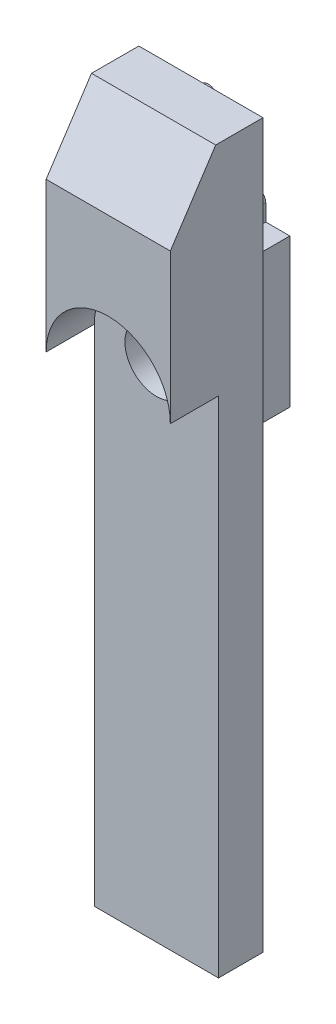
SolidWorks part; units mm, degrees
ref_plane "前视基准面" through (0, 0, 0) normal (0, 0, 1) x (1, 0, 0)
ref_plane "上视基准面" through (0, 0, 0) normal (0, 1, 0) x (1, 0, 0)
ref_plane "右视基准面" through (0, 0, 0) normal (1, 0, 0) x (0, 0, -1)
sketch "草图1" plane through (0, 0, 0) normal (0, 0, 1) x (1, 0, 0)
  line L1 (-16.75, -97.5) -> (16.75, -97.5)
  line L2 (-16.75, -97.5) -> (-16.75, 97.5)
  line L3 (-16.75, 97.5) -> (16.75, 97.5)
  line L4 (16.75, -97.5) -> (16.75, 97.5)
  line L5 (-16.75, -97.5) -> (16.75, 97.5) construction
  line L6 (-16.75, 97.5) -> (16.75, -97.5) construction
  point P0 (0, 0)
  dimension "D1" = 33.5
  dimension "D2" = 195
extrude "拉伸1" add sketch "草图1" along normal blind 25
sketch "草图2" plane through (0, 0, 25) normal (0, 0, 1) x (1, 0, 0)
  line L0 (-71.336, 38.5) -> (56.3179, 38.5) construction
  line L1 (16.75, 97.5) -> (-16.75, 97.5) construction
  line L2 (0, 0) -> (0, 102.4986) construction
  line L3 (16.75, -97.5) -> (16.75, 97.5) construction
  line L4 (-16.75, -97.5) -> (16.75, -97.5) construction
  line L5 (-16.75, 97.5) -> (-16.75, -97.5) construction
  line L6 (-16.75, -97.5) -> (16.75, -97.5)
  line L7 (-16.75, 38.5) -> (-16.75, -97.5)
  line L8 (16.75, -97.5) -> (16.75, 38.5)
  arc A0 (16.75, 38.5) -> (-16.75, 38.5) centre (0, 38.5) ccw
  dimension "D1" = 59
extrude "拉伸2" cut sketch "草图2" against normal blind 13
ref_plane "基准面2" [suppressed] through (0, 0, 0) normal (1, 0, 0) x (0, 0, -1)
sketch "草图3" plane through (-16.75, 0, 0) normal (-1, 0, 0) x (0, 0, 1)
  line L0 (5.5392, 108.5061) -> (31.4029, 69.0947)
extrude "拉伸3" cut sketch "草图3" against normal through all and the other way through all
sketch "草图4" plane through (0, 0, 12) normal (0, 0, 1) x (1, 0, 0)
  circle A0 centre (0, 38.5) radius 8.5
  dimension "D1" = 17
extrude "拉伸4" cut sketch "草图4" against normal through all
sketch "草图5" plane through (0, 0, 0) normal (0, 0, -1) x (-1, 0, 0)
  line L0 (2.5, 58.5) -> (9, 58.5)
  line L1 (49.1843, 38.5) -> (0, 38.5) construction
  line L2 (0, 38.5) -> (0, 75.0905) construction
  line L3 (-9, 18.5) -> (-2.5, 18.5)
  line L4 (-9, 18.5) -> (-9, 58.5)
  line L5 (-9, 58.5) -> (-2.5, 58.5)
  line L6 (9, 18.5) -> (9, 58.5)
  line L7 (-9, 18.5) -> (9, 58.5) construction
  line L8 (-9, 58.5) -> (9, 18.5) construction
  line L9 (2.5, 18.5) -> (2.5, 14)
  line L10 (-2.5, 58.5) -> (-2.5, 63)
  line L11 (-2.5, 18.5) -> (-2.5, 14)
  line L12 (2.5, 58.5) -> (2.5, 63)
  line L13 (-2.9533, 53.311) -> (2.0327, 64.4554) construction
  line L14 (-2.0327, 64.4554) -> (2.1378, 53.0623) construction
  line L15 (2.5, 18.5) -> (9, 18.5)
  circle A0 centre (0, 38.5) radius 8.5 construction
  circle A1 centre (0, 38.5) radius 8.5
  arc A2 (2.5, 63) -> (-2.5, 63) centre (0, 63) ccw
  arc A3 (2.5, 14) -> (-2.5, 14) centre (0, 14) cw
  point P11 (-0.2033, 59.4577)
  point P26 (-0.2033, 17.5423)
  dimension "D3" = 5
  dimension "D4" = 49
  dimension "D1" = 40
  dimension "D2" = 18
extrude "拉伸5" add sketch "草图5" along normal blind 15
sketch "草图6" plane through (0, 0, 0) normal (0, 0, -1) x (-1, 0, 0)
  line L0 (0, 0) -> (0, 50000) construction
  circle A0 centre (0, 93.5) radius 2.5
  circle A1 centre (0, -71.5) radius 2.5
  circle A2 centre (0, 38.5) radius 8.5 construction
  dimension "D1" = 5
  dimension "D2" = 55
  dimension "D3" = 110
extrude "拉伸6" add sketch "草图6" along normal blind 2
sketch "草图8" [suppressed] plane through (0, 0, 0) normal (1, 0, 0) x (0, 0, -1)
  line L3 (-22.0122, -64.5136) -> (-21.4245, -88.0181)
  line L4 (-24.2594, 25.3756) -> (-22.0594, -62.6229) construction
  line L5 (-20.4249, -88.9931) -> (-12, -88.9931)
  line L6 (-22.5279, -63.956) -> (-21.231, -65.3581)
  line L7 (-19.7628, -66) -> (-18.2361, -66)
  line L8 (-17.3416, -65.7889) -> (-12.1056, -63.1708)
  line L9 (-22.0122, -64.5136) -> (-21.231, -65.3581)
  line L10 (-19.7628, -66) -> (-18.2361, -66)
  line L11 (-17.3416, -65.7889) -> (-12.1056, -63.1708)
  line L12 (-12, -97.5) -> (-12, 38.5) construction
  line L13 (-12, -88.9931) -> (-12, -63.114)
  arc A4 (-21.4245, -88.0181) -> (-20.4249, -88.9931) centre (-20.4249, -87.9931) ccw
  arc A8 (-23.0591, -62.6479) -> (-22.5279, -63.956) centre (-21.0597, -62.5979) ccw
  arc A9 (-21.231, -65.3581) -> (-19.7628, -66) centre (-19.7628, -64) ccw
  arc A10 (-18.2361, -66) -> (-17.3416, -65.7889) centre (-18.2361, -64) ccw
  arc A11 (-12.1056, -63.1708) -> (-11, -61.382) centre (-13, -61.382) ccw
  arc A13 (-21.231, -65.3581) -> (-19.7628, -66) centre (-19.7628, -64) ccw
  arc A14 (-18.2361, -66) -> (-17.3416, -65.7889) centre (-18.2361, -64) ccw
  arc A15 (-12.1056, -63.1708) -> (-12, -63.114) centre (-13, -61.382) ccw
  dimension "D2" = 1
  dimension "D1" = 1
extrude "拉伸7" [suppressed] add sketch "草图8" along normal mid plane 20 contours A15 L11 A14 L10 A13 L9 L3 A4 L5 L13
